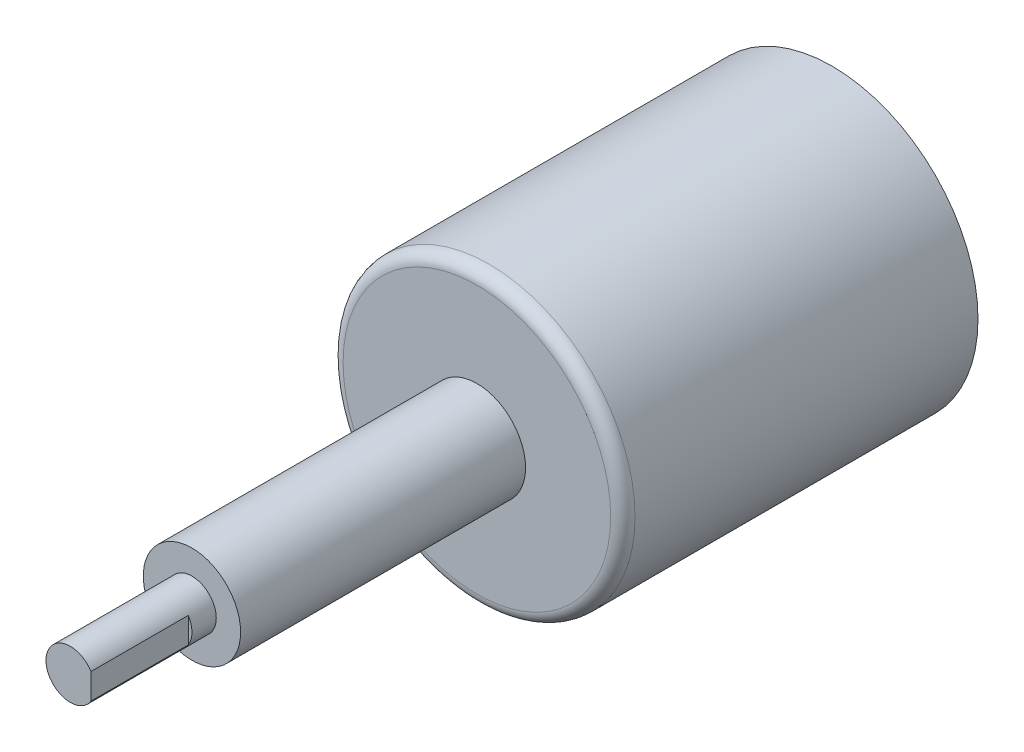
SolidWorks part; units mm, degrees
ref_plane "Plan de face" through (0, 0, 0) normal (0, 0, 1) x (1, 0, 0)
ref_plane "Plan de dessus" through (0, 0, 0) normal (0, 1, 0) x (1, 0, 0)
ref_plane "Plan de droite" through (0, 0, 0) normal (1, 0, 0) x (0, 0, -1)
sketch "Esquisse1" plane through (0, 0, 0) normal (0, 0, 1) x (1, 0, 0)
  circle A0 centre (0, 0) radius 12
extrude "Extrusion1" add sketch "Esquisse1" along normal blind 29.2
fillet "Congé1" radius 1 1 edges at (12, 0, 29.2)
sketch "Esquisse2" plane through (0, 0, 29.2) normal (0, 0, 1) x (1, 0, 0)
  circle A0 centre (0, 0) radius 4
extrude "Extrusion2" add sketch "Esquisse2" along normal blind 23.43
sketch "Esquisse3" plane through (0, 0, 52.63) normal (0, 0, 1) x (1, 0, 0)
  circle A0 centre (0, 0) radius 2
extrude "Extrusion3" add sketch "Esquisse3" along normal blind 10
sketch "Esquisse4" plane through (0, 0, 62.63) normal (0, 0, 1) x (1, 0, 0)
  line L1 (4.165, 3.8095) -> (1.7, 3.8095)
  line L2 (4.165, 3.8095) -> (4.165, -4.3697)
  line L3 (4.165, -4.3697) -> (1.7, -4.3697)
  line L4 (1.7, 3.8095) -> (1.7, -4.3697)
  dimension "D1" = 1.7
extrude "Enlèv. mat.-Extru.1" cut sketch "Esquisse4" against normal blind 8
